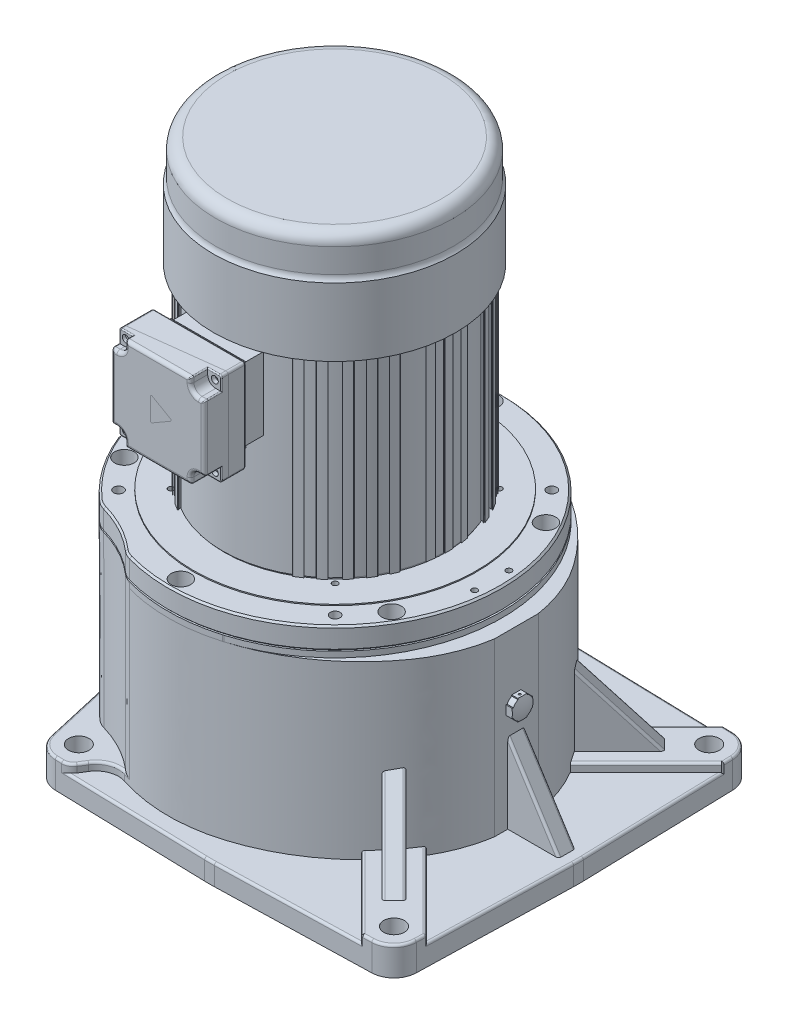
SolidWorks part; units mm, degrees
ref_plane "前视基准面" through (0, 0, 0) normal (0, 0, 1) x (1, 0, 0)
ref_plane "上视基准面" through (0, 0, 0) normal (0, 1, 0) x (1, 0, 0)
ref_plane "右视基准面" through (0, 0, 0) normal (1, 0, 0) x (0, 0, -1)
imported_body "接线盒座-1-surface1"
imported_body "接线盒座-1-surface2"
imported_body "接线盒座-1-surface3"
imported_body "接线盒座-1-surface4"
imported_body "接线盒座-1-surface5"
imported_body "接线盒座-1-surface6"
imported_body "接线盒座-1-surface7"
imported_body "接线盒盖-1-surface1"
imported_body "接线盒盖-1-surface2"
imported_body "5034.2200.106-00-1-surface2"
imported_body "5034.2200.106-00-1-surface3"
imported_body "5034.2200.106-00-1-surface4"
imported_body "5034.2200.106-00-1-surface5"
imported_body "5034.2200.106-00-1-surface6"
imported_body "5034.2200.106-00-1-surface7"
imported_body "5034.2200.106-00-1-surface8"
imported_body "5034.2200.106-00-1-surface9"
imported_body "5034.2200.106-00-1-surface10"
imported_body "5034.2200.106-00-1-surface11"
imported_body "5034.2200.106-00-1-surface12"
imported_body "5034.2200.106-00-1-surface13"
imported_body "5034.2200.106-00-1-surface14"
imported_body "5034.2200.106-00-1-surface15"
imported_body "5034.2200.106-00-1-surface16"
imported_body "5034.2200.106-00-1-surface17"
imported_body "5034.2200.106-00-1-surface18"
imported_body "5034.2200.106-00-1-surface19"
imported_body "5034.2200.106-00-1-surface20"
imported_body "5034.2200.106-00-1-surface21"
imported_body "5034.2200.106-00-1-surface22"
imported_body "5034.2200.106-00-1-surface23"
imported_body "5034.2200.106-00-1-surface24"
imported_body "5034.2200.106-00-1-surface25"
imported_body "5034.2200.106-00-1-surface26"
imported_body "5034.2200.106-00-1-surface27"
imported_body "5034.2200.106-00-1-surface28"
imported_body "5034.2200.106-00-1-surface29"
imported_body "5034.2200.106-00-1-surface30"
imported_body "5034.2200.106-00-1-surface31"
imported_body "5034.2200.106-00-1-surface32"
imported_body "5034.2200.106-00-1-surface33"
imported_body "5034.2200.106-00-1-surface34"
imported_body "5034.2200.106-00-1-surface35"
imported_body "5034.2200.106-00-1-surface36"
imported_body "5034.2200.106-00-1-surface37"
imported_body "5034.2200.106-00-1-surface38"
imported_body "5034.2200.106-00-1-surface39"
imported_body "5034.2200.106-00-1-surface40"
imported_body "5034.2200.106-00-1-surface41"
imported_body "5034.2200.106-00-1-surface42"
imported_body "5034.2200.106-00-1-surface43"
imported_body "5034.2200.106-00-1-surface44"
imported_body "5034.2200.106-00-1-surface45"
imported_body "5034.2200.106-00-1-surface46"
imported_body "5034.2200.106-00-1-surface47"
imported_body "5034.2200.106-00-1-surface48"
imported_body "5034.2200.106-00-1-surface49"
imported_body "5034.2200.106-00-1-surface50"
imported_body "5034.2200.106-00-1-surface51"
imported_body "5034.2200.106-00-1-surface52"
imported_body "5034.2200.106-00-1-surface53"
imported_body "5034.2200.106-00-1-surface54"
imported_body "5034.2200.106-00-1-surface55"
imported_body "5034.2200.106-00-1-surface56"
imported_body "5034.2200.106-00-1-surface57"
imported_body "5034.2200.106-00-1-surface58"
imported_body "5034.2200.106-00-1-surface59"
imported_body "5034.2200.106-00-1-surface60"
imported_body "5034.2200.106-00-1-surface61"
imported_body "5034.2200.106-00-1-surface62"
imported_body "5034.2200.106-00-1-surface63"
imported_body "5034.2200.106-00-1-surface64"
imported_body "5034.2200.106-00-1-surface65"
imported_body "5034.2200.106-00-1-surface66"
imported_body "5034.2200.106-00-1-surface67"
imported_body "50箱盖-1-surface1"
imported_body "立式箱体-1-surface1"
imported_body "立式箱体-1-surface2"
imported_body "立式箱体-1-surface3"
imported_body "透气塞-1-surface1"
sketch "草图1" plane through (0, -154.2551, 0) normal (0, 1, 0) x (1, 0, 0)
  circle A0 centre (15.5509, 127.454) radius 98
  circle A1 centre (67.5509, 127.454) radius 52 construction
extrude "凸台-拉伸1" add sketch "草图1" along normal blind 169.5
sketch "草图2" plane through (0, 15.2449, 0) normal (0, 1, 0) x (1, 0, 0)
  circle A0 centre (15.5509, 127.454) radius 106
extrude "凸台-拉伸2" add sketch "草图2" along normal blind 59.5
sketch "草图3" plane through (0, 74.7449, 0) normal (0, 1, 0) x (1, 0, 0)
  circle A0 centre (15.5509, 127.454) radius 104
extrude "凸台-拉伸3" add sketch "草图3" along normal blind 36
fillet "圆角1" radius 10 1 edges at (15.5509, 110.7449, -23.454)
fillet "圆角2" radius 7 1 edges at (15.5509, 74.7449, -23.454)
